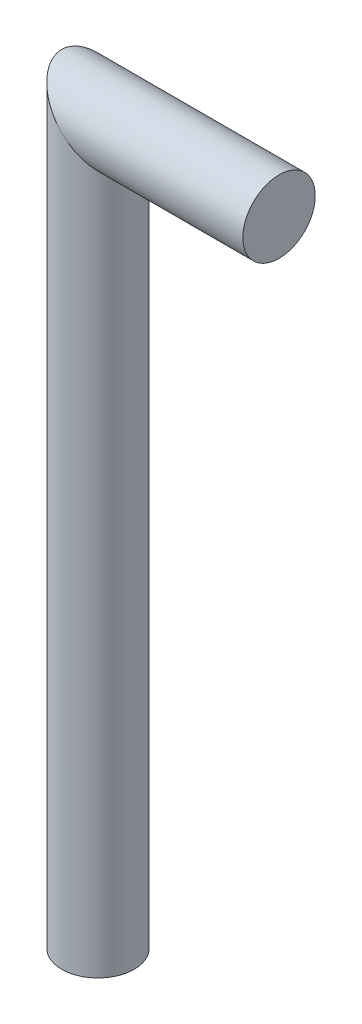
SolidWorks part; units mm, degrees
ref_plane "Alzado" through (0, 0, 0) normal (0, 0, 1) x (1, 0, 0)
ref_plane "Planta" through (0, 0, 0) normal (0, 1, 0) x (1, 0, 0)
ref_plane "Vista lateral" through (0, 0, 0) normal (1, 0, 0) x (0, 0, -1)
sketch "Croquis1" plane through (0, 0, 0) normal (0, 1, 0) x (1, 0, 0)
  circle A0 centre (0, 0) radius 6
  dimension "D1" = 12
sketch "Croquis2" plane through (0, 0, 0) normal (0, 0, 1) x (1, 0, 0)
  line L0 (0, 0) -> (0, 120)
  line L1 (0, 120) -> (30, 120)
  dimension "D1" = 120
  dimension "D2" = 30
sweep "Barrer1" add profiles "Croquis1" path "Croquis2"
